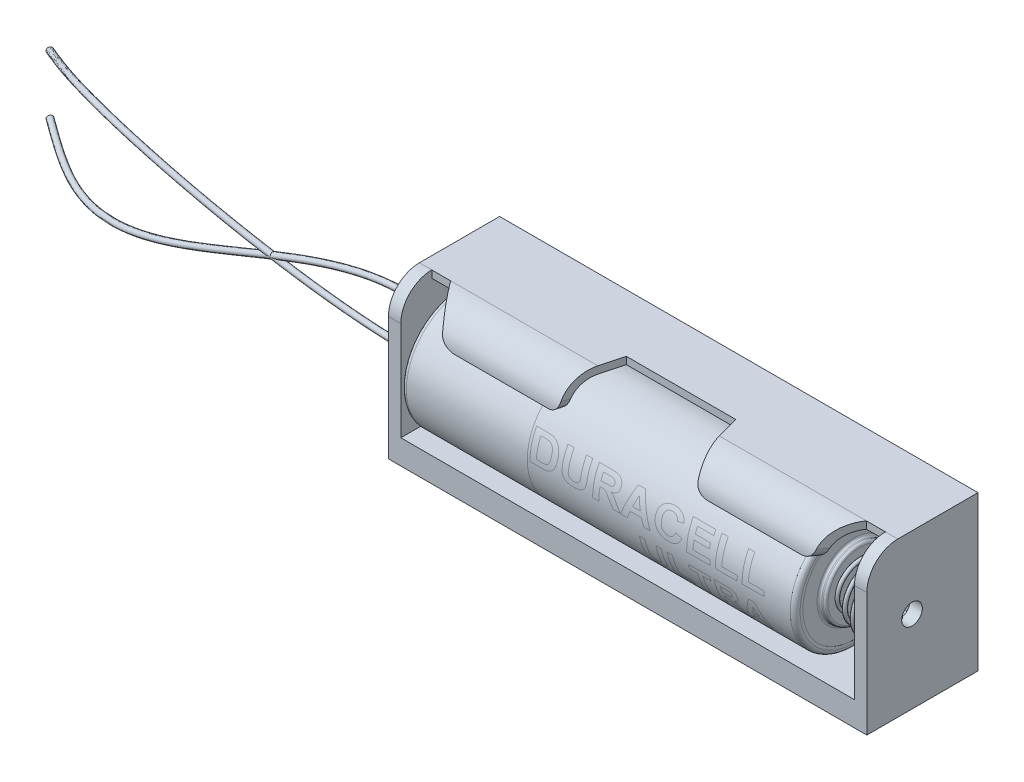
SolidWorks part; units mm, degrees
ref_plane "Front Plane" through (0, 0, 0) normal (0, 0, 1) x (1, 0, 0)
ref_plane "Top Plane" through (0, 0, 0) normal (0, 1, 0) x (1, 0, 0)
ref_plane "Right Plane" through (0, 0, 0) normal (1, 0, 0) x (0, 0, -1)
imported_body "Imported30"
imported_body "Imported31"
imported_body "Imported32"
imported_body "Imported33"
imported_body "Imported34"
imported_body "Imported35"
imported_body "Imported36"
imported_body "Surface-Imported60"
sketch "Sketch1" plane through (0, 0, 13.6906) normal (0, 0, 1) x (1, 0, 0)
  line L0 (-29.464, 12.7) -> (-29.464, -12.7) construction
  line L1 (-29.464, -0.508) -> (29.464, -0.508)
  line L2 (-29.464, -0.508) -> (-29.464, -16.51)
  line L3 (-29.464, -16.51) -> (29.464, -16.51)
  line L4 (29.464, -0.508) -> (29.464, -16.51)
  line L5 (29.464, -16.51) -> (29.464, -12.7) construction
extrude "Extrude1" cut sketch "Sketch1" against normal mid plane 40
sketch "Sketch2" plane through (0, -0.508, 0) normal (0, -1, 0) x (1, 0, 0)
  line L1 (-29.464, 13.6906) -> (29.464, 13.6906)
  line L2 (-29.464, 13.6906) -> (-29.464, 0)
  line L3 (-29.464, 0) -> (29.464, 0)
  line L4 (29.464, 13.6906) -> (29.464, 0)
extrude "Extrude2" add sketch "Sketch2" along normal blind 2
